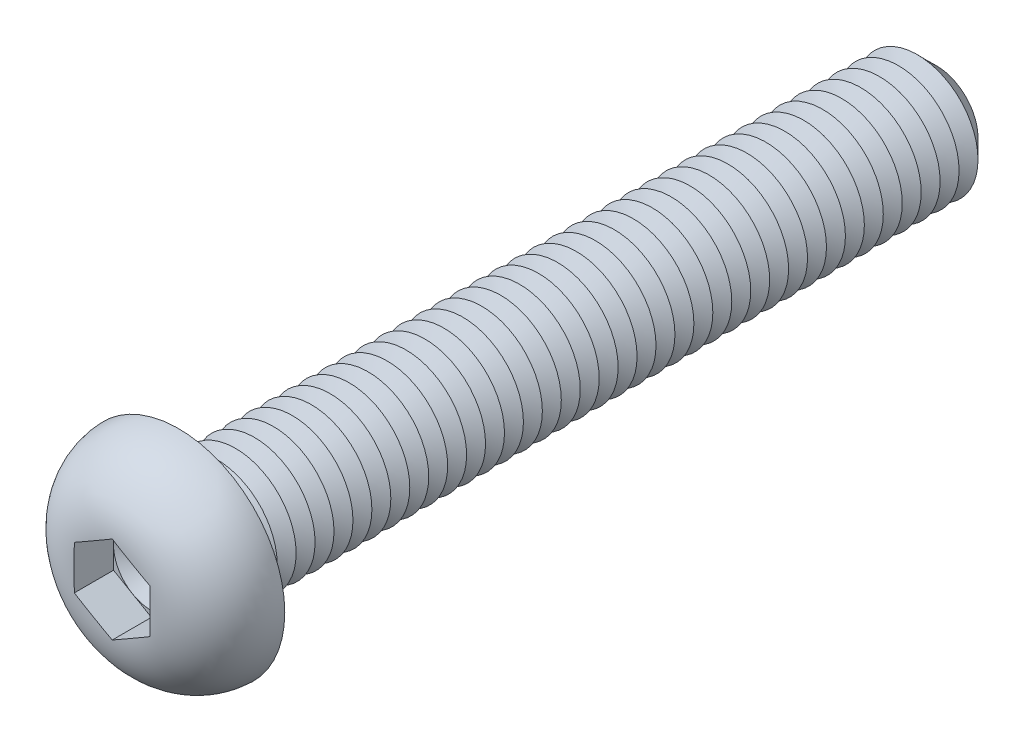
SolidWorks part; units mm, degrees
ref_plane "Front Plane" through (0, 0, 0) normal (0, 0, 1) x (1, 0, 0)
ref_plane "Top Plane" through (0, 0, 0) normal (0, 1, 0) x (1, 0, 0)
ref_plane "Right Plane" through (0, 0, 0) normal (1, 0, 0) x (0, 0, -1)
sketch "Sketch1" plane through (0, 0, 0) normal (1, 0, 0) x (0, 0, -1)
  line L0 (-47.9342, 0) -> (60.3146, 0) construction
sketch "Sketch2" plane through (0, 0, 0) normal (1, 0, 0) x (0, 0, -1)
  line L0 (0, 0) -> (-4.4, 0)
  line L1 (-47.9342, 0) -> (60.3146, 0) construction
  line L2 (-4.4, 0) -> (-4.4, 2.5011)
  line L3 (0, 7) -> (0, 0)
  arc A0 (-4.4, 2.5011) -> (0, 7) centre (0.1, 2.5011) cw
  dimension "D1" = 4.5
  dimension "D2" = 4.4
  dimension "D3" = 7
revolve "Revolve1" add sketch "Sketch2" angle 360 about L0
sketch "Sketch3" plane through (0, 0, 4.4) normal (0, 0, 1) x (1, 0, 0)
  line L1 (0, 2.8868) -> (-2.5, 1.4434)
  line L2 (-2.5, 1.4434) -> (-2.5, -1.4434)
  line L3 (-2.5, -1.4434) -> (0, -2.8868)
  line L4 (0, -2.8868) -> (2.5, -1.4434)
  line L5 (2.5, -1.4434) -> (2.5, 1.4434)
  line L6 (2.5, 1.4434) -> (0, 2.8868)
  circle A0 centre (0, 0) radius 2.5 construction
  dimension "D1" = 5
extrude "Cut-Extrude1" cut sketch "Sketch3" against normal blind 2.6
sketch "Sketch4" plane through (0, 0, 0) normal (0, 0, -1) x (-1, 0, 0)
  circle A0 centre (0, 0) radius 4
  dimension "D1" = 8
extrude "Boss-Extrude1" add sketch "Sketch4" along normal blind 50
chamfer "Chamfer1" distance 1.25 angle 45 1 edges at (-4, 0, -50)
sketch "Sketch5" plane through (0, 0, 0) normal (1, 0, 0) x (0, 0, -1)
  line L0 (1.25, 4) -> (2.5, 4)
  line L1 (48.75, 4) -> (0, 4) construction
  line L2 (2.5, 4) -> (1.875, 2.9175)
  line L3 (1.875, 2.9175) -> (1.25, 4)
  line L4 (0, -7) -> (0, 7) construction
  line L5 (48.75, 4) -> (0, 4) construction
  dimension "D1" = 1.25
  dimension "D2" = 1.25
revolve "Cut-Revolve1" cut sketch "Sketch5" angle 360 about L0
pattern_linear "LPattern1" count 38 spacing 1.25 along (0, 0, -1) of "Cut-Revolve1"
fillet "Fillet2" radius 0.5 1 edges at (4, 0, 0)
sketch "Sketch6" plane through (0, 0, 1.8) normal (0, 0, 1) x (1, 0, 0)
  line L0 (0, -2.8868) -> (2.5, -1.4434) construction
  circle A0 centre (0, 0) radius 2.5
extrude "Cut-Extrude2" cut sketch "Sketch6" against normal through all draft 60
